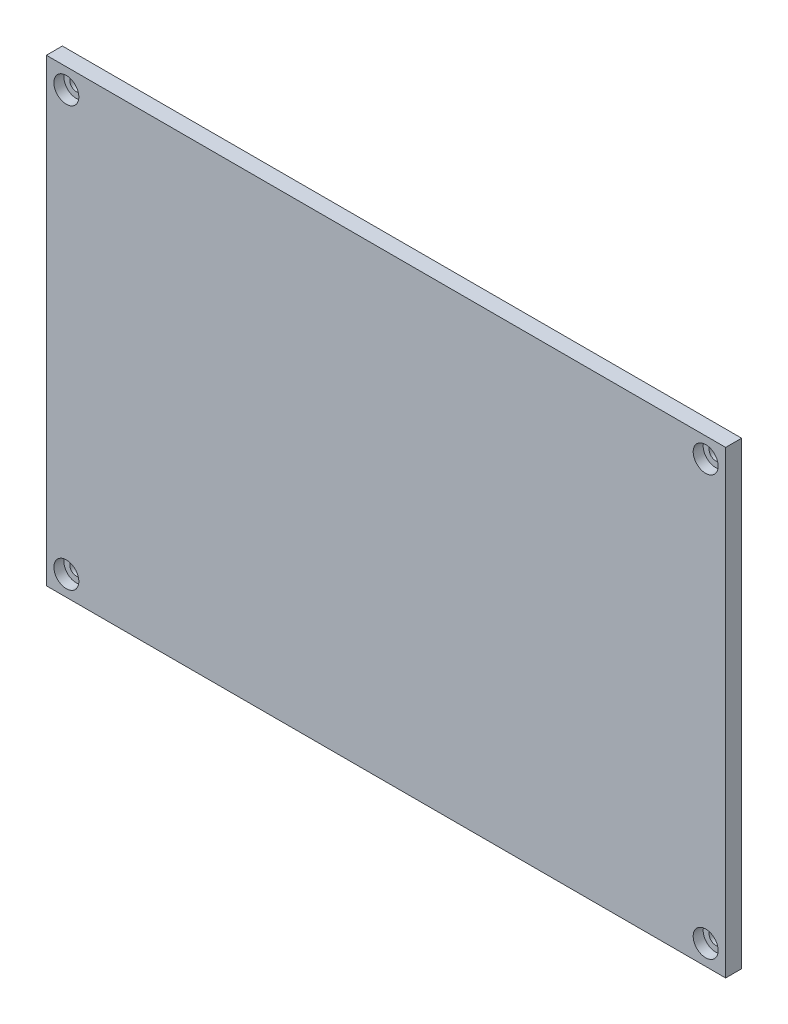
SolidWorks part; units mm, degrees
ref_plane "Planta" through (0, 0, 0) normal (0, 0, 1) x (1, 0, 0)
ref_plane "Perfil" through (0, 0, 0) normal (0, 1, 0) x (1, 0, 0)
ref_plane "Alzado" through (0, 0, 0) normal (1, 0, 0) x (0, 0, -1)
sketch "Croquis1" plane through (0, 0, 0) normal (0, 0, 1) x (1, 0, 0)
  line L1 (85, -57.5) -> (-85, -57.5)
  line L2 (85, -57.5) -> (85, 57.5)
  line L3 (85, 57.5) -> (-85, 57.5)
  line L4 (-85, -57.5) -> (-85, 57.5)
  line L5 (85, -57.5) -> (-85, 57.5) construction
  line L6 (85, 57.5) -> (-85, -57.5) construction
  point P0 (0, 0)
  dimension "D1" = 170
  dimension "D2" = 115
extrude "Saliente-Extruir1" add sketch "Croquis1" along normal blind 4
sketch "Croquis2" plane through (0, 0, 4) normal (0, 0, 1) x (1, 0, 0)
  line L0 (-85, 57.5) -> (-85, -57.5) construction
  line L2 (85, 57.5) -> (-85, 57.5) construction
  line L3 (-80, 52.5) -> (80, 52.5) construction
  line L4 (80, 52.5) -> (80, -52.5) construction
  line L5 (80, -52.5) -> (-80, -52.5) construction
  line L6 (-80, -52.5) -> (-80, 52.5) construction
  line L7 (85, -57.5) -> (85, 57.5) construction
  line L8 (-85, -57.5) -> (85, -57.5) construction
  circle A0 centre (-80, -52.5) radius 3.125
  circle A1 centre (-80, 52.5) radius 3.125
  circle A2 centre (80, 52.5) radius 3.125
  circle A3 centre (80, -52.5) radius 3.125
  dimension "D1" = 6.25
  dimension "D3" = 5
  dimension "D5" = 5
  dimension "D2" = 5
  dimension "D4" = 5
extrude "Cortar-Extruir1" cut sketch "Croquis2" against normal blind 2.5
sketch "Croquis3" plane through (0, 0, 1.5) normal (0, 0, 1) x (1, 0, 0)
  circle A0 centre (-80, 52.5) radius 1.65
  circle A1 centre (80, 52.5) radius 1.65
  circle A2 centre (80, -52.5) radius 1.65
  circle A3 centre (-80, -52.5) radius 1.65
  dimension "D1" = 3.3
extrude "Cortar-Extruir2" cut sketch "Croquis3" against normal up to next
sketch "Croquis5" plane through (0, 0, 0) normal (0, 0, -1) x (-1, 0, 0)
  circle A1 centre (-11.5328, 29.0747) radius 1
  circle A2 centre (-11.5339, 2.0747) radius 1
  circle A3 centre (-62.4376, -4.3) radius 1
  circle A4 centre (-62.4376, 36.7577) radius 1
  circle A5 centre (-62.4376, 36.7577) radius 3
  circle A6 centre (-11.5328, 29.0747) radius 3
  circle A7 centre (-11.5339, 2.0747) radius 3
  circle A8 centre (-62.4376, -4.3) radius 3
  dimension "D1" = 2
  dimension "D2" = 6
extrude "Saliente-Extruir2" add sketch "Croquis5" along normal blind 5
chamfer "Chaflán1" distance 2 angle 45 4 edges at (65.4376, 36.7577, 0) (14.5328, 29.0747, 0) (14.5339, 2.0747, 0) (65.4376, -4.3, 0)
sketch "Croquis6" plane through (0, 0, 0) normal (0, 0, -1) x (-1, 0, 0)
  line L0 (0, 50) -> (0, 3.3063) construction
  line L1 (72, 50) -> (-72, 50) construction
  line L2 (-72, 3.3063) -> (72, 3.3063) construction
  line L3 (-37.8144, 26.6532) -> (37.8144, 26.6532) construction
  line L5 (-0.3, 9.1032) -> (0.3, 9.1032)
  line L6 (-0.3, 9.1032) -> (-0.3, 44.2032)
  line L7 (-0.3, 44.2032) -> (0.3, 44.2032)
  line L8 (0.3, 9.1032) -> (0.3, 44.2032)
  line L9 (-0.3, 9.1032) -> (0.3, 44.2032) construction
  line L10 (-0.3, 44.2032) -> (0.3, 9.1032) construction
  line L11 (-1.8, 7.6032) -> (1.8, 7.6032)
  line L12 (-1.8, 7.6032) -> (-1.8, 45.7032)
  line L13 (-1.8, 45.7032) -> (1.8, 45.7032)
  line L14 (1.8, 7.6032) -> (1.8, 45.7032)
  line L15 (-1.8, 7.6032) -> (1.8, 45.7032) construction
  line L16 (-1.8, 45.7032) -> (1.8, 7.6032) construction
  point P6 (0, 26.6532)
  point P9 (0, 26.6532)
  point P14 (0, 26.6532)
  dimension "D1" = 35.1
  dimension "D2" = 0.6
  dimension "D3" = 1.5
  dimension "D4" = 1.5
extrude "Saliente-Extruir3" add sketch "Croquis6" along normal blind 10
chamfer "Chaflán2" distance 4.75 angle 65 2 edges at (-1.8, 26.6532, 0) (1.8, 26.6532, 0)
sketch "Croquis12" plane through (0, 0, -10) normal (0, 0, -1) x (-1, 0, 0)
  line L1 (1.8869, 45.7032) -> (8.5029, 45.7032)
  line L2 (1.8869, 45.7032) -> (1.8869, 42.7032)
  line L3 (1.8869, 42.7032) -> (8.5029, 42.7032)
  line L4 (8.5029, 45.7032) -> (8.5029, 42.7032)
  dimension "D1" = 3
extrude "Cortar-Extruir5" cut sketch "Croquis12" against normal up to vertex
sketch "Croquis13" plane through (0, 0, 0) normal (0, 0, -1) x (-1, 0, 0)
  line L0 (-68.7792, -7.6381) -> (-55.4885, -7.6381)
  line L1 (-55.4885, -7.6381) -> (-55.4885, -10.7058)
  line L2 (-55.4885, -10.7058) -> (-68.7792, -10.7058)
  line L3 (-68.7792, -10.7058) -> (-68.7792, -7.6381)
extrude "Cortar-Extruir8" cut sketch "Croquis13" along normal blind 6
sketch "Croquis14" plane through (0, 0, 0) normal (0, 0, -1) x (-1, 0, 0)
  line L0 (17.2505, 18.5) -> (17.7505, 18.5) construction
  line L1 (17.2505, 28.5) -> (9.2505, 28.5)
  line L2 (17.2505, 28.5) -> (17.2505, 8.5)
  line L3 (17.2505, 8.5) -> (9.2505, 8.5)
  line L4 (9.2505, 28.5) -> (9.2505, 8.5)
  line L5 (17.7505, -8.9999) -> (17.7505, 45.9999) construction
  line L6 (32.5, 47.5) -> (32.5, -2.1235) construction
  line L7 (61.2695, 47.5) -> (3.7305, 47.5) construction
  line L8 (47.7495, 18.5) -> (47.2495, 18.5) construction
  line L9 (55.7495, 28.5) -> (55.7495, 8.5)
  line L10 (47.7495, 8.5) -> (55.7495, 8.5)
  line L11 (47.7495, 28.5) -> (47.7495, 8.5)
  line L12 (47.7495, 28.5) -> (55.7495, 28.5)
  dimension "D1" = 20
  dimension "D2" = 8
  dimension "D3" = 0.5
extrude "Cortar-Extruir9" cut sketch "Croquis14" against normal blind 2
sketch "Croquis15" plane through (0, 0, 0) normal (0, 0, -1) x (-1, 0, 0)
  line L0 (59.25, 53.5) -> (5.75, 53.5) construction
  line L1 (15, 51) -> (50, 51)
  line L2 (15, 51) -> (15, 53.5)
  line L3 (15, 53.5) -> (50, 53.5)
  line L4 (50, 51) -> (50, 53.5)
  line L5 (15.5, 51.5) -> (15.5, 53.5) construction
  line L6 (49.5, 51.5) -> (49.5, 53.5) construction
  line L7 (49.5, 51.5) -> (15.5, 51.5) construction
  dimension "D1" = 0.5
  dimension "D2" = 0.5
  dimension "D3" = 0.5
extrude "Cortar-Extruir10" cut sketch "Croquis15" against normal blind 2.25
sketch "Croquis16" plane through (-15, 0, 0) normal (-1, 0, 0) x (0, 0, 1)
  line L0 (2.25, 53.5) -> (2.25, 53.701)
  line L1 (2.25, 53.701) -> (0, 55)
  line L2 (0, -57.5) -> (0, 57.5) construction
  line L3 (0, 55) -> (0, 54.7113)
  line L4 (2, 53.5566) -> (-0.5, 55) construction
  line L7 (2.25, 53.5) -> (0, 53.5) construction
  line L8 (2, 51.5) -> (2, 53.5566) construction
  line L9 (2, 53.5) -> (2.25, 53.5)
  line L10 (2, 53.5) -> (0, 53.5)
  line L11 (0, 53.5) -> (0, 54.7113)
extrude "Cortar-Extruir11" cut sketch "Croquis16" along normal up to surface (35 mm away) contours L1 L3 L11 L10 L9 L0
sketch "Croquis17" plane through (0, 0, 0) normal (0, 0, -1) x (-1, 0, 0)
  line L1 (0.3, 9.1032) -> (-0.3, 9.1032)
  line L2 (0.3, 9.1032) -> (0.3, 44.2032)
  line L3 (0.3, 44.2032) -> (-0.3, 44.2032)
  line L4 (-0.3, 9.1032) -> (-0.3, 44.2032)
extrude "Saliente-Extruir4" add sketch "Croquis17" along normal blind 1.125
